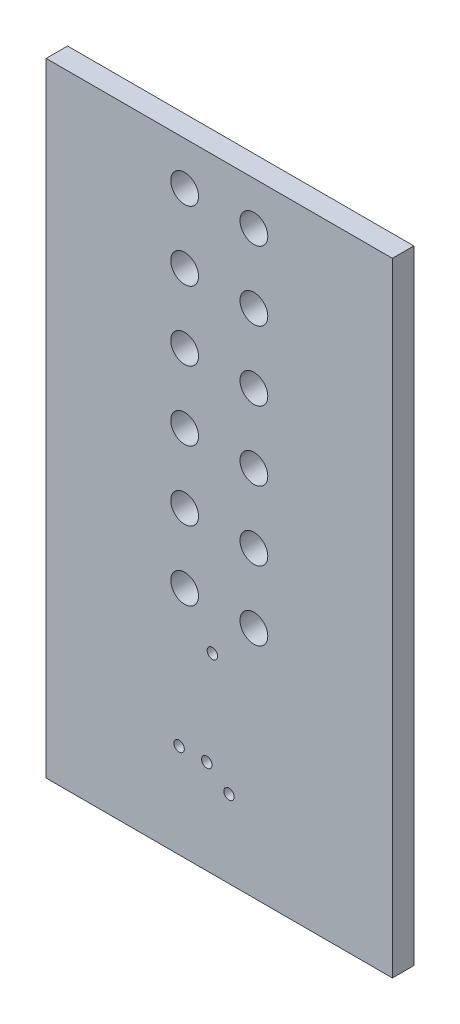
SolidWorks part; units mm, degrees
ref_plane "Front Plane" through (0, 0, 0) normal (0, 0, 1) x (1, 0, 0)
ref_plane "Top Plane" through (0, 0, 0) normal (0, 1, 0) x (1, 0, 0)
ref_plane "Right Plane" through (0, 0, 0) normal (1, 0, 0) x (0, 0, -1)
ref_plane "Dielectric_Layer Layer 1" through (0, 0, 0.7874) normal (0, 0, 1) x (1, 0, 0)
sketch "Sketch1" plane through (0, 0, 0) normal (0, 0, 1) x (1, 0, 0)
  line L0 (0, 0) -> (0, 22.86)
  line L1 (0, 22.86) -> (12.7, 22.86)
  line L2 (12.7, 22.86) -> (12.7, 0)
  line L3 (12.7, 0) -> (0, 0)
extrude "Board_Outline" add sketch "Sketch1" along normal blind 0.7874 separate body
sketch "Sketch2" plane through (0, 0, 0) normal (0, 0, 1) x (1, 0, 0)
  circle A0 centre (4.8768, 3.4544) radius 0.1905
  circle A1 centre (6.096, 7.0104) radius 0.1905
  circle A2 centre (5.8928, 3.4544) radius 0.1905
  circle A3 centre (6.7056, 2.8448) radius 0.1905
extrude "NPTH" cut sketch "Sketch2" along normal through all
sketch "Sketch3" plane through (0, 0, 0) normal (0, 0, 1) x (1, 0, 0)
  circle A0 centre (7.62, 8.57) radius 0.51
  circle A1 centre (7.62, 11.11) radius 0.51
  circle A2 centre (7.62, 13.65) radius 0.51
  circle A3 centre (7.62, 16.19) radius 0.51
  circle A4 centre (7.62, 18.73) radius 0.51
  circle A5 centre (7.62, 21.27) radius 0.51
  circle A6 centre (5.08, 8.57) radius 0.51
  circle A7 centre (5.08, 11.11) radius 0.51
  circle A8 centre (5.08, 13.65) radius 0.51
  circle A9 centre (5.08, 16.19) radius 0.51
  circle A10 centre (5.08, 18.73) radius 0.51
  circle A11 centre (5.08, 21.27) radius 0.51
extrude "PTH" cut sketch "Sketch3" along normal through all
